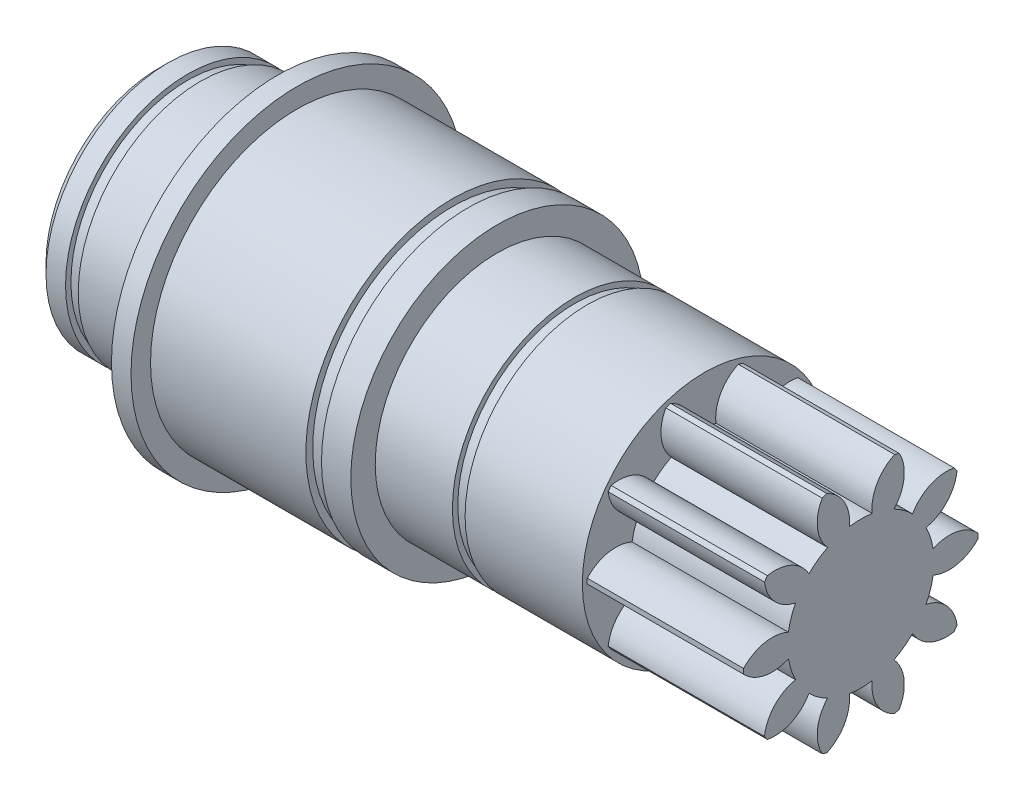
SolidWorks part; units mm, degrees
ref_plane "Plane1" through (0, 0, 0) normal (0, 0, 1) x (1, 0, 0)
ref_plane "Plane2" through (0, 0, 0) normal (0, 1, 0) x (1, 0, 0)
ref_plane "Plane3" through (0, 0, 0) normal (1, 0, 0) x (0, 0, -1)
sketch "HoldingSke" plane through (0, 0, 0) normal (0, 1, 0) x (1, 0, 0)
  line L0 (0, 0) -> (0.4924, -0.0868)
  line L1 (-15, 0) -> (100, 0) construction
  line L2 (0, 0) -> (-2.1039, 2.3779)
  line L3 (0, 0) -> (-11.863, 4.5341)
  line L4 (0, 0) -> (8.5048, 1.4996)
  line L5 (0, 0) -> (-46.8476, -17.4728)
  line L6 (0, 0) -> (-13.2634, -8.9489)
  line L7 (-2.1039, 2.3779) -> (8.6586, 51.2059)
  line L8 (-76.2, 54.61) -> (-73.9, 54.61)
  line L9 (-71.009, 38.7566) -> (-53.1078, 45.2721)
  line L10 (-76.2, 71.12) -> (104.1128, 71.12)
  line L11 (0, 0) -> (-16, 0)
  line L12 (-76.2, 101.6) -> (-76.133, 101.6)
  line L13 (24.9733, 27.94) -> (52.9518, 28.4284)
  line L14 (24.9733, 27.94) -> (24.9743, 27.94)
  line L15 (24.9733, 27.94) -> (100.4006, 29.5858)
  line L16 (-63.627, -2) -> (-12.827, -2)
  circle A0 centre (0, 0) radius 8
  circle A1 centre (0, 0) radius 7.499
  circle A2 centre (0, 0) radius 37.5
  circle A3 centre (0, 0) radius 7.4736
  dimension "MHD" = 14.998
  dimension "Hub_dia" = 75
  dimension "Bore" = 16
  dimension "MBD" = 14.9472
  dimension "Num_teeth" = 10
  dimension "Pitch_radius" = 180.3128
  dimension "Pitch" = 0.5
  dimension "Width" = 16
  dimension "Overall_len" = 50
  dimension "Show_teeth" = 10
  dimension "Thickness" = 16
  dimension "OAL" = 50.0001
  dimension "T_dim" = 2.3
  dimension "Ap" = 20
  dimension "H" = 19.05
  dimension "Backlash" = 0.067
  dimension "Addendum_fac" = 1
  dimension "Dedendum_fac" = 1.25
  dimension "Clearance_fac" = 0.25
  dimension "Dedendum_add" = 0.001
  dimension "Module" = 2
sketch "BasProSke" plane through (0, 0, 0) normal (0, 1, 0) x (1, 0, 0)
  line L0 (-10, 0) -> (60, 0) construction
  line L1 (0, 0) -> (0, 12)
  line L2 (0, 0) -> (16, 0)
  line L3 (16, 0) -> (16, 12)
  line L4 (16, 12) -> (0, 12)
  dimension "Diameter" = 24
  dimension "Thickness" = 16
revolve "Base-Revolve" add sketch "BasProSke" angle 360 about L0
sketch "TooCutSke" plane through (0, 0, 0) normal (1, 0, 0) x (0, 0, -1)
  line L1 (0, 0) -> (0, 107) construction
  line L2 (0, 0) -> (-1.6814, 9.8576) construction
  line L3 (0, 0) -> (-6.1153, 18.8209) construction
  line L4 (-1.6814, 9.8576) -> (-3.0576, 9.4105) construction
  arc A0 (1.1737, 7.4066) -> (-1.1737, 7.4066) centre (0, 0) ccw
  arc A1 (3.4979, 11.5054) -> (-3.4979, 11.5054) centre (0, 0) ccw
  circle A2 centre (0, 0) radius 10 construction
  circle A3 centre (0, 0) radius 9.3969 construction
  arc A4 (-1.1737, 7.4066) -> (-3.4979, 11.5054) centre (-5.1477, 7.8615) ccw
  arc A5 (3.4979, 11.5054) -> (1.1737, 7.4066) centre (5.1477, 7.8615) ccw
  dimension "Root_dia" = 14.998
  dimension "Overcut_dia" = 24.0508
  dimension "Pitch_dia" = 20
  dimension "Base_dia" = 18.7939
  dimension "Flank_rad" = 4
  dimension "Half_ang" = 18
  dimension "Half_CT" = 1.4471
extrude "ToothCut" cut sketch "TooCutSke" along normal through all
fillet "Breaks" [suppressed] radius 0.04
fillet "RootFillets" [suppressed] radius 0.501
pattern_circular "TeethCuts" count 10 every 36 about axis through (-10, 0, 0) along (1, 0, 0) of "ToothCut", "RootFillets", "Breaks"
sketch "HubNeaOneSke" plane through (0, 0, 0) normal (-1, 0, 0) x (0, 0, 1)
  circle A0 centre (0, 0) radius 7.499
  dimension "Diameter" = 14.998
extrude "HubNearOne" [suppressed] add sketch "HubNeaOneSke" along normal blind 34.0001
sketch "HubNeaBotSke" plane through (0, 0, 0) normal (-1, 0, 0) x (0, 0, 1)
  circle A0 centre (0, 0) radius 7.499
  dimension "Diameter" = 14.998
extrude "HubNearBoth" [suppressed] add sketch "HubNeaBotSke" along normal blind 17
ref_plane "FarPln" through (16, 0, 0) normal (1, 0, 0) x (0, 0, -1)
sketch "HubFarSke" plane through (16, 0, 0) normal (1, 0, 0) x (0, 0, -1)
  circle A0 centre (0, 0) radius 7.499
  dimension "Diameter" = 14.998
extrude "HubFar" [suppressed] add sketch "HubFarSke" along normal blind 17
sketch "BorSke" plane through (0, 0, 0) normal (1, 0, 0) x (0, 0, -1)
  circle A0 centre (0, 0) radius 7.4736
  dimension "Diameter" = 14.9472
extrude "Bore" cut sketch "BorSke" along normal mid plane 100.0001
sketch "KeySke" plane through (0, 0, 0) normal (1, 0, 0) x (0, 0, -1)
  line L0 (-2.5, 0) -> (-2.5, 9.7736)
  line L1 (-2.5, 9.7736) -> (2.5, 9.7736)
  line L2 (2.5, 9.7736) -> (2.5, 0)
  line L3 (0, 0) -> (0, 34) construction
  line L4 (-2.5, 0) -> (2.5, 0)
  dimension "Offset" = 9.7736
  dimension "Width" = 5
extrude "Keyway" [suppressed] cut sketch "KeySke" along normal mid plane 100.0001
pattern_circular "Keyway2" [suppressed] count 2 every 90 about axis through (-10, 0, 0) along (1, 0, 0)
sketch "Esquisse1" plane through (16, 0, 0) normal (1, 0, 0) x (0, 0, -1)
  circle A0 centre (0, 0) radius 7.499
  arc A1 (3.404, -6.6819) -> (5.303, -5.3022) centre (0, 0) ccw construction
extrude "Extrusion2" add sketch "Esquisse1" against normal blind 16
sketch "Esquisse2" plane through (0, 0, 0) normal (-1, 0, 0) x (0, 0, 1)
  circle A0 centre (0, 0) radius 12.5
  dimension "D1" = 25
extrude "Extrusion3" add sketch "Esquisse2" along normal blind 12
sketch "Esquisse3" plane through (-12, 0, 0) normal (-1, 0, 0) x (0, 0, 1)
  circle A0 centre (0, 0) radius 11.95
  dimension "D1" = 23.9
extrude "Extrusion4" add sketch "Esquisse3" along normal blind 1.3
sketch "Esquisse4" plane through (-13.3, 0, 0) normal (-1, 0, 0) x (0, 0, 1)
  circle A0 centre (0, 0) radius 12.5
  dimension "D1" = 25
extrude "Extrusion5" add sketch "Esquisse4" along normal blind 7.9
sketch "Esquisse5" plane through (-21.2, 0, 0) normal (-1, 0, 0) x (0, 0, 1)
  circle A0 centre (0, 0) radius 15
  dimension "D1" = 30
extrude "Extrusion6" add sketch "Esquisse5" along normal blind 3
sketch "Esquisse6" plane through (-24.2, 0, 0) normal (-1, 0, 0) x (0, 0, 1)
  circle A0 centre (0, 0) radius 14.3
  dimension "D1" = 28.6
extrude "Extrusion7" add sketch "Esquisse6" along normal blind 1.6
sketch "Esquisse7" plane through (-25.8, 0, 0) normal (-1, 0, 0) x (0, 0, 1)
  circle A0 centre (0, 0) radius 15
  dimension "D1" = 30
extrude "Extrusion8" add sketch "Esquisse7" along normal blind 15.9
sketch "Esquisse8" plane through (-41.7, 0, 0) normal (-1, 0, 0) x (0, 0, 1)
  circle A0 centre (0, 0) radius 17
  dimension "D1" = 34
extrude "Extrusion9" add sketch "Esquisse8" along normal blind 2
sketch "Esquisse9" plane through (-43.7, 0, 0) normal (-1, 0, 0) x (0, 0, 1)
  circle A0 centre (0, 0) radius 12.5
  dimension "D1" = 25
extrude "Extrusion11" add sketch "Esquisse9" along normal blind 7.9
sketch "Esquisse10" plane through (-51.6, 0, 0) normal (-1, 0, 0) x (0, 0, 1)
  circle A0 centre (0, 0) radius 11.95
  dimension "D1" = 23.9
extrude "Extrusion12" add sketch "Esquisse10" along normal blind 1.3
sketch "Esquisse11" plane through (-52.9, 0, 0) normal (-1, 0, 0) x (0, 0, 1)
  circle A0 centre (0, 0) radius 12.5
  dimension "D1" = 25
extrude "Extrusion13" add sketch "Esquisse11" along normal blind 3
chamfer "Chanfrein1" distance 1 angle 45 1 edges at (-55.9, 0, 12.5)
sketch "Esquisse12" plane through (-25.8, 0, 0) normal (1, 0, 0) x (0, 0, -1)
  line L0 (-1.3083, -18.3504) -> (-8.9735, -16.06)
  line L1 (-8.9735, -16.06) -> (-6.9694, -9.353)
  line L2 (-6.9694, -9.353) -> (0.6957, -11.6434)
  line L3 (0.6957, -11.6434) -> (-1.3083, -18.3504)
  dimension "D1" = 7
extrude "Enlèv. mat.-Extru.1" cut sketch "Esquisse12" against normal blind 15
equation "' \"Module@HoldingSke\" = 6.35"
equation "' \"Num_teeth@HoldingSke\" = 12"
equation "' \"Ap@HoldingSke\" =  20"
equation "' \"Width@HoldingSke\" = 0.5 * 25.4"
equation "' \"Hub_dia@HoldingSke\"= 1 * 25.4"
equation "' \"Overall_len@HoldingSke\" = 1.0 * 25.4"
equation "' \"Bore@HoldingSke\" = 0.75 * 25.4"
equation "' \"T_dim@HoldingSke\" = 0.1 * 25.4"
equation "' \"Width@KeySke\" = 0.25 * 25.4"
equation "' \"Show_teeth@HoldingSke\" = 13"
equation "' \"Backlash@HoldingSke\" = 0.009 * 25.4"
equation "' \"Addendum_fac@HoldingSke\" = 1.0"
equation "' \"Dedendum_fac@HoldingSke\" = 1.25"
equation "' \"Dedendum_add@HoldingSke\" = 0.00005 * 25.4"
equation "' \"Clearance_fac@HoldingSke\" = 0.25"
equation "\"Pitch@HoldingSke\" = 1 / \"Module@HoldingSke\""
equation "\"Overcut_dia@TooCutSke\" = (\"Num_teeth@HoldingSke\" + 2 * \"Addendum_fac@HoldingSke\") / \"Pitch@HoldingSke\" + 0.002 * 25.4"
equation "\"Pitch_dia@TooCutSke\" = \"Num_teeth@HoldingSke\" / \"Pitch@HoldingSke\""
equation "\"Base_dia@TooCutSke\" = \"Num_teeth@HoldingSke\" / \"Pitch@HoldingSke\" * cos((\"Ap@HoldingSke\"  * 3.14159265 / 180))"
equation "\"Root_dia@TooCutSke\" = (\"Num_teeth@HoldingSke\" + 2) / \"Pitch@HoldingSke\" - 2 * (\"Addendum_fac@HoldingSke\" + \"Dedendum_fac@HoldingSke\") / \"Pitch@HoldingSke\" - \"Dedendum_add@HoldingSke\" * 2"
equation "\"Half_ang@TooCutSke\" = 180 / \"Num_teeth@HoldingSke\""
equation "\"Half_CT@TooCutSke\" = \"Num_teeth@HoldingSke\" / \"Pitch@HoldingSke\" * sin((3.14159265 / 2 / \"Num_teeth@HoldingSke\")) / 2 - 7 * \"Backlash@HoldingSke\" / 4"
equation "\"Flank_rad@TooCutSke\" = \"Num_teeth@HoldingSke\" / \"Pitch@HoldingSke\" / 5"
equation "\"Radius@RootFillets\" = \"Clearance_fac@HoldingSke\" / \"Pitch@HoldingSke\" + \"Dedendum_add@HoldingSke\""
equation "\"Break_rad@Breaks\" = 0.02 / \"Pitch@HoldingSke\""
equation "\"Thickness@HoldingSke\" = \"Width@HoldingSke\""
equation "\"OAL@HoldingSke\" = \"Thickness@HoldingSke\""
equation "\"MHD@HoldingSke\" = (\"Num_teeth@HoldingSke\" + 2) / \"Pitch@HoldingSke\" - 2 * (\"Addendum_fac@HoldingSke\" + \"Dedendum_fac@HoldingSke\")  / \"Pitch@HoldingSke\" - \"Dedendum_add@HoldingSke\" * 2"
equation "\"MBD@HoldingSke\" = (\"Num_teeth@HoldingSke\" + 2) / \"Pitch@HoldingSke\" - 2 * (\"Addendum_fac@HoldingSke\" + \"Dedendum_fac@HoldingSke\")  / \"Pitch@HoldingSke\" - \"Dedendum_add@HoldingSke\" * 2 - 0.002 * 25.4"
equation "\"MHD@HoldingSke\" = ((sgn( \"MHD@HoldingSke\" - \"Hub_dia@HoldingSke\" )-1)*( \"MHD@HoldingSke\" - \"Hub_dia@HoldingSke\" ))/-2+ \"Hub_dia@HoldingSke\""
equation "\"MBD@HoldingSke\" = ((sgn( \"MBD@HoldingSke\" - \"Bore@HoldingSke\" )-1)*( \"MBD@HoldingSke\" - \"Bore@HoldingSke\" ))/-2+ \"Bore@HoldingSke\""
equation "\"OAL@HoldingSke\" = ((sgn( \"OAL@HoldingSke\" - \"Overall_len@HoldingSke\" )+1)*( \"OAL@HoldingSke\" - \"Overall_len@HoldingSke\" ))/2 + \"Overall_len@HoldingSke\" + 0.000002 * 25.4"
equation "\"Num_teeth@TeethCuts\" = int( \"Show_teeth@HoldingSke\" ) + 1"
equation "\"Num_teeth@TeethCuts\" = ((sgn( \"Num_teeth@TeethCuts\" - \"Num_teeth@HoldingSke\" )-1)*( \"Num_teeth@TeethCuts\" - \"Num_teeth@HoldingSke\" ))/-2+ \"Num_teeth@HoldingSke\""
equation "\"Num_teeth@TeethCuts\" = ((sgn( \"Num_teeth@TeethCuts\" - 2.0)+1)*( \"Num_teeth@TeethCuts\" - 2.0))/2 +2.0"
equation "\"Angle@TeethCuts\" = 360.0 / \"Num_teeth@HoldingSke\""
equation "\"Diameter@BasProSke\" = (\"Num_teeth@HoldingSke\" + 2 * \"Addendum_fac@HoldingSke\") / \"Pitch@HoldingSke\""
equation "\"Thickness@BasProSke\"  = \"Thickness@HoldingSke\""
equation "' \"Fillet_rad@BasProSke\" =  \"Thickness@HoldingSke\" * 0.05"
equation "\"MHD@HoldingSke\" = ((sgn( \"MHD@HoldingSke\" - \"Root_dia@TooCutSke\" )-1)*( \"MHD@HoldingSke\" - \"Root_dia@TooCutSke\" ))/-2+ \"Root_dia@TooCutSke\""
equation "\"Diameter@HubNeaOneSke\" = \"MHD@HoldingSke\""
equation "\"Length@HubNearOne\" = \"OAL@HoldingSke\" - \"Thickness@BasProSke\""
equation "\"Diameter@HubNeaBotSke\" = \"MHD@HoldingSke\""
equation "\"Length@HubNearBoth\" = ( \"OAL@HoldingSke\" - \"Thickness@BasProSke\" ) / 2.0"
equation "\"Thickness@FarPln\" = \"Thickness@BasProSke\""
equation "\"Diameter@HubFarSke\" = \"MHD@HoldingSke\""
equation "\"Length@HubFar\" = ( \"OAL@HoldingSke\" - \"Thickness@BasProSke\" ) / 2.0"
equation "\"Diameter@BorSke\" = \"MBD@HoldingSke\""
equation "\"D1@Bore\" = \"OAL@HoldingSke\" * 2.0"
equation "\"D1@Keyway\" = \"OAL@HoldingSke\" * 2.0"
equation "\"Offset@KeySke\" = \"T_dim@HoldingSke\" + \"MBD@HoldingSke\" / 2.0"
